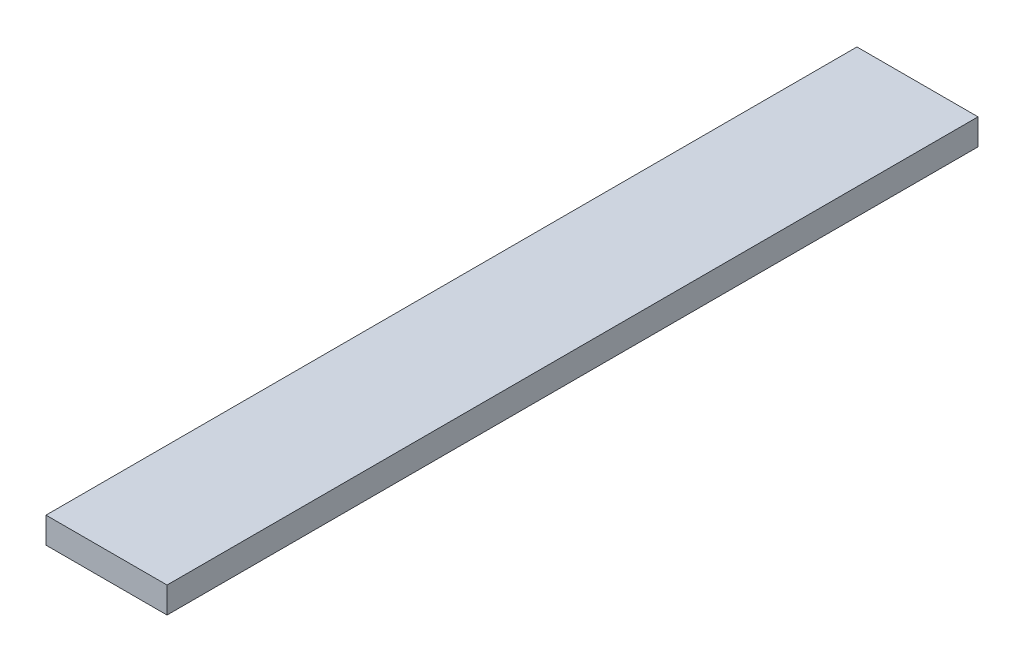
SolidWorks part; units mm, degrees
ref_plane "Front Plane" through (0, 0, 0) normal (0, 0, 1) x (1, 0, 0)
ref_plane "Top Plane" through (0, 0, 0) normal (0, 1, 0) x (1, 0, 0)
ref_plane "Right Plane" through (0, 0, 0) normal (1, 0, 0) x (0, 0, -1)
sketch "Sketch1" plane through (0, 0, 0) normal (0, 1, 0) x (1, 0, 0)
  line L1 (-295.275, 1978.0707) -> (295.275, 1978.0707)
  line L2 (-295.275, 1978.0707) -> (-295.275, -1978.0707)
  line L3 (-295.275, -1978.0707) -> (295.275, -1978.0707)
  line L4 (295.275, 1978.0707) -> (295.275, -1978.0707)
  line L5 (-295.275, 1978.0707) -> (295.275, -1978.0707) construction
  line L6 (-295.275, -1978.0707) -> (295.275, 1978.0707) construction
  point P0 (0, 0)
  dimension "D1" = 590.55
  dimension "D2" = 3956.1414
extrude "Boss-Extrude1" add sketch "Sketch1" along normal blind 127
